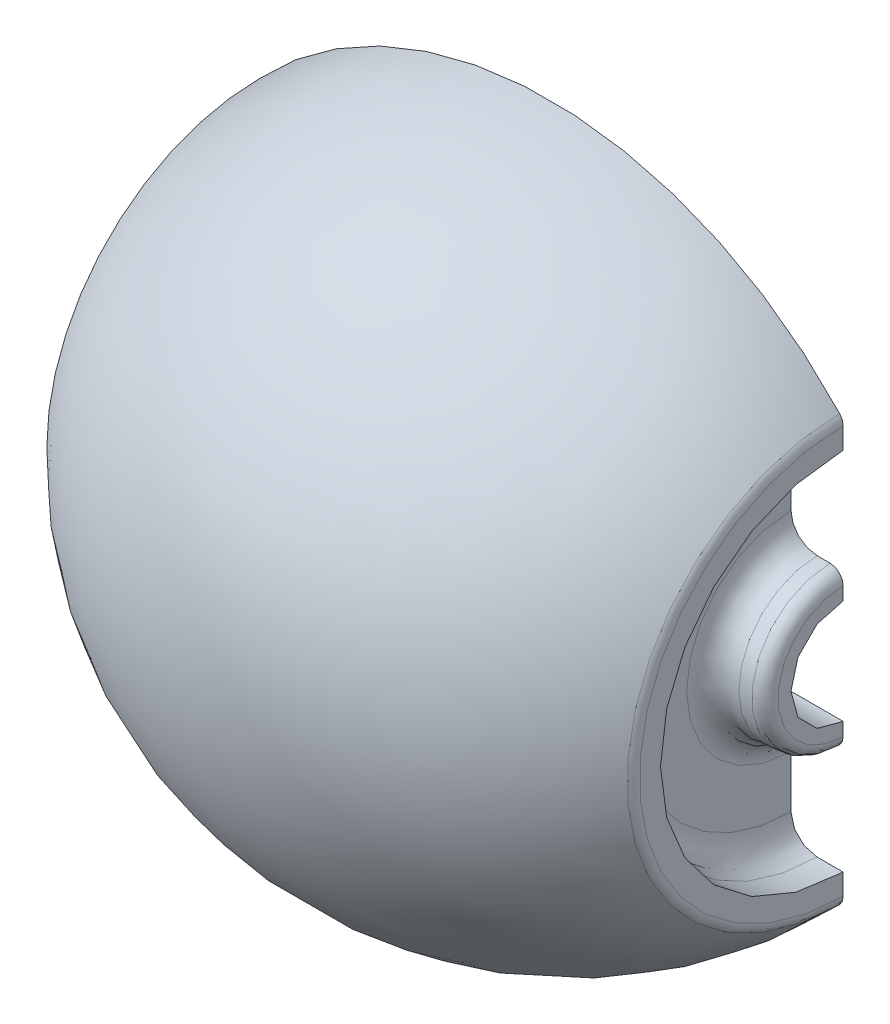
SolidWorks part; units mm, degrees
ref_plane "Plan de face" through (0, 0, 0) normal (0, 0, 1) x (1, 0, 0)
ref_plane "Plan de dessus" through (0, 0, 0) normal (0, 1, 0) x (1, 0, 0)
ref_plane "Plan de droite" through (0, 0, 0) normal (1, 0, 0) x (0, 0, -1)
sketch "Esquisse1" plane through (0, 0, 0) normal (0, 0, 1) x (1, 0, 0)
  line L0 (-37.5326, 0) -> (29.2218, 0) construction
  line L1 (0, 26.8874) -> (0, -16.5174) construction
  line L2 (-11.25, 2) -> (11.25, 2)
  line L3 (-11.25, 2) -> (-11.25, 2.5)
  line L4 (-10.75, 3) -> (-10.25, 3)
  line L5 (-9.25, 4) -> (-9.25, 6)
  line L6 (-10.25, 7) -> (-11.25, 7)
  line L7 (-11.25, 7) -> (-11.25, 7.8058)
  line L8 (-27.1194, 13) -> (24.6642, 13) construction
  line L9 (11.25, 7) -> (11.25, 7.8058)
  line L10 (10.25, 7) -> (11.25, 7)
  line L11 (9.25, 4) -> (9.25, 6)
  line L12 (10.75, 3) -> (10.25, 3)
  line L13 (11.25, 2) -> (11.25, 2.5)
  arc A0 (-11.1167, 8.1457) -> (11.1167, 8.1457) centre (0, -2.1562) cw
  arc A1 (-10.75, 3) -> (-11.25, 2.5) centre (-10.75, 2.5) ccw
  arc A2 (-11.25, 7.8058) -> (-11.1167, 8.1457) centre (-10.75, 7.8058) cw
  arc A3 (-9.25, 6) -> (-10.25, 7) centre (-10.25, 6) ccw
  arc A4 (-9.25, 4) -> (-10.25, 3) centre (-10.25, 4) cw
  arc A5 (9.25, 4) -> (10.25, 3) centre (10.25, 4) ccw
  arc A6 (9.25, 6) -> (10.25, 7) centre (10.25, 6) cw
  arc A7 (11.25, 7.8058) -> (11.1167, 8.1457) centre (10.75, 7.8058) ccw
  arc A8 (10.75, 3) -> (11.25, 2.5) centre (10.75, 2.5) cw
  point P18 (-11.25, 3)
  point P21 (-11.25, 8)
  point P24 (-9.25, 7)
  point P27 (-9.25, 3)
  point P41 (0, 2)
  dimension "D8" = 0.5
  dimension "D9" = 1
  dimension "D10" = 1
  dimension "D1" = 13
  dimension "D2" = 2
  dimension "D3" = 1
  dimension "D4" = 2
  dimension "D5" = 1
  dimension "D6" = 4
  dimension "D7" = 11.25
revolve "Révolution1" add sketch "Esquisse1" angle 180 about L0
